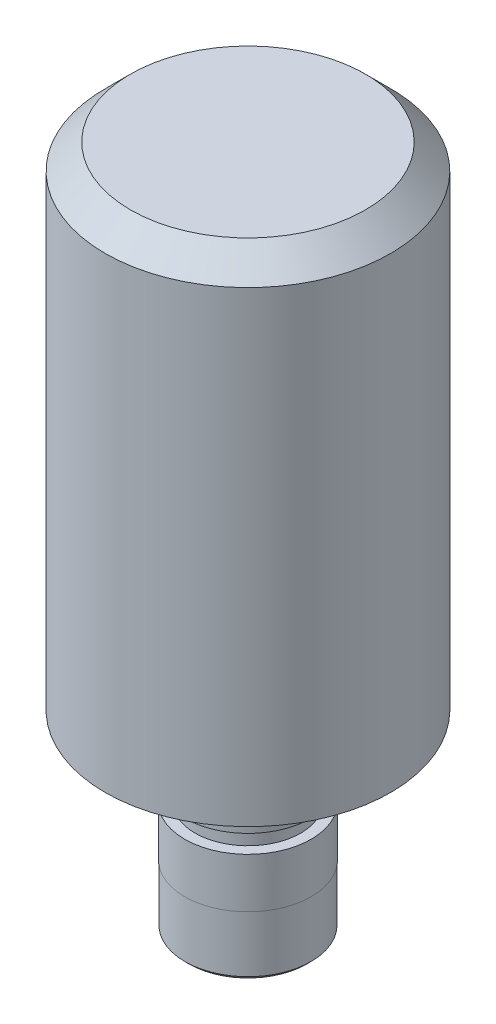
SolidWorks part; units mm, degrees
ref_plane "Front" through (0, 0, 0) normal (0, 0, 1) x (1, 0, 0)
ref_plane "Top" through (0, 0, 0) normal (0, 1, 0) x (1, 0, 0)
ref_plane "Right" through (0, 0, 0) normal (1, 0, 0) x (0, 0, -1)
sketch "Sketch1" plane through (0, 0, 0) normal (0, 1, 0) x (1, 0, 0)
  circle A0 centre (0, 0) radius 17.9959
  dimension "D1" = 35.9918
extrude "Extrude1" add sketch "Sketch1" against normal blind 62.0268
chamfer "Chamfer1" distance 3.175 angle 45
sketch "Sketch2" plane through (0, -62.0268, 0) normal (0, -1, 0) x (1, 0, 0)
  circle A0 centre (0, 0) radius 7.9756
  dimension "D1" = 15.9512
extrude "Extrude2" add sketch "Sketch2" along normal blind 16.383
sketch "Sketch3" plane through (0, -78.4098, 0) normal (0, -1, 0) x (1, 0, 0)
  circle A0 centre (0, 0) radius 7.9375
  dimension "D1" = 15.875
extrude "Extrude3" add sketch "Sketch3" along normal blind 7.62
sketch "Sketch4" plane through (0, -86.0298, 0) normal (0, -1, 0) x (1, 0, 0)
  circle A0 centre (0, 0) radius 6.0325
  dimension "D1" = 12.065
extrude "Cut-Extrude1" cut sketch "Sketch4" against normal blind 10.922
chamfer "Chamfer7" distance 0.508 angle 45
sketch "Sketch5" plane through (0, -62.0268, 0) normal (0, -1, 0) x (1, 0, 0)
  line L0 (0, 19.4395) -> (0, -1.5687) construction
  circle A0 centre (0, 11.049) radius 1.9939
  circle A1 centre (0, 0) radius 17.9959 construction
  dimension "D1" = 3.9878
  dimension "D2" = 4.953
extrude "Cut-Extrude2" cut sketch "Sketch5" against normal blind 1.27
sketch "Sketch6" plane through (0, 0, 0) normal (1, 0, 0) x (0, 0, -1)
  line L0 (0, 2.4063) -> (0, -89.3854) construction
  line L1 (-7.9756, -62.0268) -> (-7.9756, -78.4098) construction
  line L2 (-7.9756, -65.8368) -> (-6.6548, -65.8368)
  line L3 (-7.9756, -65.8368) -> (-7.9756, -68.1228)
  line L4 (-7.9756, -68.1228) -> (-6.6548, -68.1228)
  line L5 (-6.6548, -65.8368) -> (-6.6548, -68.1228)
  line L6 (-17.9959, -62.0268) -> (17.9959, -62.0268) construction
  line L7 (-7.9756, -69.85) -> (-6.6548, -69.85)
  line L8 (-7.9756, -69.85) -> (-7.9756, -72.136)
  line L9 (-7.9756, -72.136) -> (-6.6548, -72.136)
  line L10 (-6.6548, -69.85) -> (-6.6548, -72.136)
  dimension "D1" = 3.81
  dimension "D2" = 2.286
  dimension "D3" = 2.286
  dimension "D4" = 1.7272
  dimension "D5" = 1.3208
  dimension "D6" = 1.3208
revolve "Cut-Revolve1" cut sketch "Sketch6" angle 360 about L0
